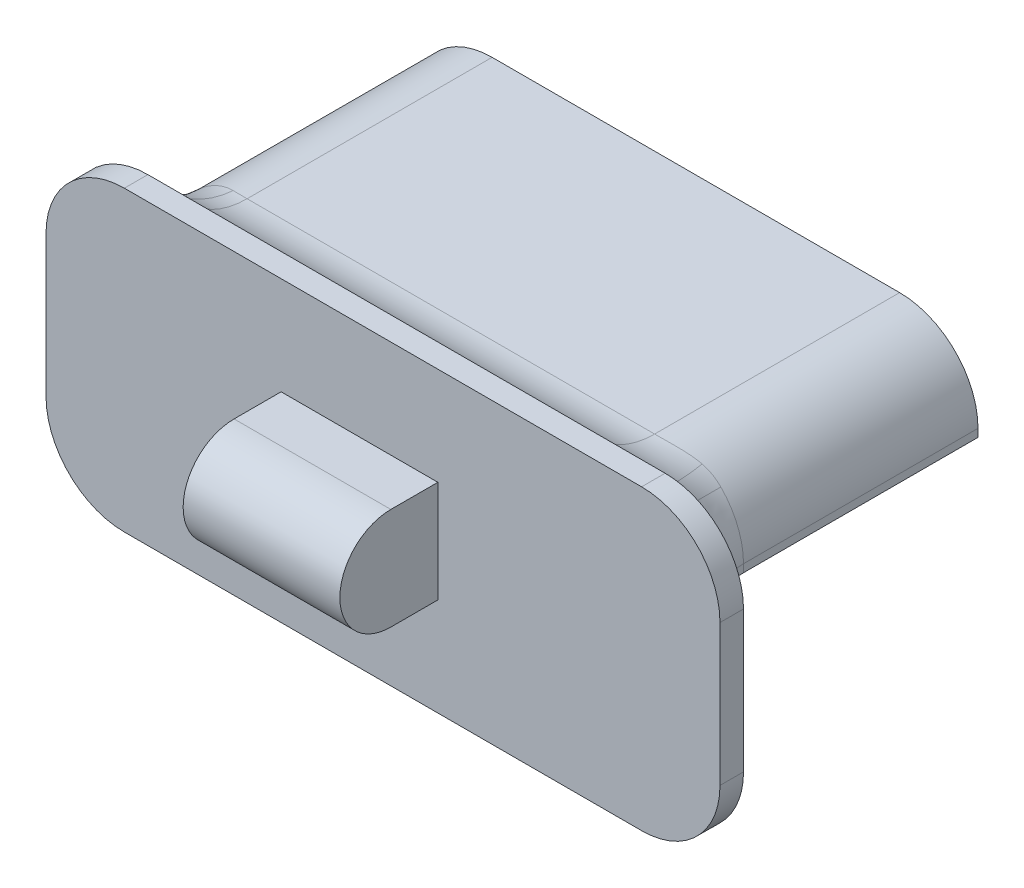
SolidWorks part; units mm, degrees
ref_plane "前视基准面" through (0, 0, 0) normal (0, 0, 1) x (1, 0, 0)
ref_plane "上视基准面" through (0, 0, 0) normal (0, 1, 0) x (1, 0, 0)
ref_plane "右视基准面" through (0, 0, 0) normal (1, 0, 0) x (0, 0, -1)
sketch "草图1" plane through (0, 0, 0) normal (0, 0, 1) x (1, 0, 0)
  line L1 (-18, -7) -> (18, -7)
  line L2 (-18, -7) -> (-18, 7)
  line L3 (-18, 7) -> (18, 7)
  line L4 (18, -7) -> (18, 7)
  line L5 (-18, -7) -> (18, 7) construction
  line L6 (-18, 7) -> (18, -7) construction
  point P0 (0, 0)
  dimension "D1" = 36
  dimension "D2" = 14
extrude "凸台-拉伸1" add sketch "草图1" along normal blind 43
sketch "草图2" plane through (0, 0, 43) normal (0, 0, 1) x (1, 0, 0)
  line L0 (-18, 7) -> (-18, -7) construction
  line L1 (-20, -9.5) -> (23, -9.5)
  line L2 (-20, -9.5) -> (-20, 9.5)
  line L3 (-20, 9.5) -> (23, 9.5)
  line L4 (23, -9.5) -> (23, 9.5)
  line L5 (-20, -9.5) -> (23, 9.5) construction
  line L6 (-20, 9.5) -> (23, -9.5) construction
  line L7 (18, -7) -> (18, 7) construction
  line L8 (-20, 0) -> (23, 0) construction
  dimension "D1" = 19
  dimension "D2" = 2
  dimension "D3" = 5
extrude "凸台-拉伸2" add sketch "草图2" against normal blind 1.5
fillet "圆角1" radius 5 4 edges at (18, -7, 20.75) (18, 7, 20.75) (-18, -7, 20.75) (-18, 7, 20.75)
fillet "圆角2" radius 3 8 edges at (16.5355, 5.5355, 0) (18, 0, 0) (16.5355, -5.5355, 0) (0, -7, 0) (-16.5355, -5.5355, 0) (-18, 0, 0) (-16.5355, 5.5355, 0) (0, 7, 0)
fillet "圆角3" radius 5 4 edges at (23, -9.5, 42.25) (23, 9.5, 42.25) (-20, 9.5, 42.25) (-20, -9.5, 42.25)
fillet "圆角4" radius 5 3 edges at (16.5355, -5.5355, 41.5) (18, 0, 41.5) (16.5355, 5.5355, 41.5)
ref_plane "基准面1" through (0, 1.5, 0) normal (0, 1, 0) x (1, 0, 0)
sketch "草图3" plane through (0, 1.5, 0) normal (0, 1, 0) x (1, 0, 0)
  line L1 (-20.2226, 2.3709) -> (20.2226, 2.3709)
  line L2 (-20.2226, 2.3709) -> (-20.2226, -40.8)
  line L3 (-20.2226, -40.8) -> (20.2226, -40.8)
  line L4 (20.2226, 2.3709) -> (20.2226, -40.8)
  line L5 (18, -43) -> (-15, -43) construction
  line L6 (0, 0) -> (0, -24.3645) construction
  dimension "D1" = 2.2
extrude "切除-拉伸1" cut sketch "草图3" against normal blind 15
sketch "草图4" plane through (0, 0, 0) normal (1, 0, 0) x (0, 0, -1)
  line L0 (-43, 0) -> (-46, 0) construction
  line L1 (-43, -4.5) -> (-43, 4.5) construction
  line L3 (-43, 3.25) -> (-46, 3.25)
  line L4 (-43, 3.25) -> (-43, -3.25)
  line L5 (-43, -3.25) -> (-46, -3.25)
  arc A0 (-46, 3.25) -> (-46, -3.25) centre (-46, 0) ccw
  dimension "D1" = 6.5
  dimension "D2" = 3
extrude "凸台-拉伸3" add sketch "草图4" along normal mid plane 10
sketch "草图5" plane through (0, 0, 0) normal (0, 1, 0) x (1, 0, 0)
  line L1 (-22.1591, -21.539) -> (19.8101, -21.539)
  line L2 (-22.1591, -21.539) -> (-22.1591, 0.8171)
  line L3 (-22.1591, 0.8171) -> (19.8101, 0.8171)
  line L4 (19.8101, -21.539) -> (19.8101, 0.8171)
  line L5 (-22.1591, -21.539) -> (19.8101, 0.8171) construction
  line L6 (-22.1591, 0.8171) -> (19.8101, -21.539) construction
  point P0 (-1.1745, -10.361)
extrude "切除-拉伸2" cut sketch "草图5" along normal blind 13
